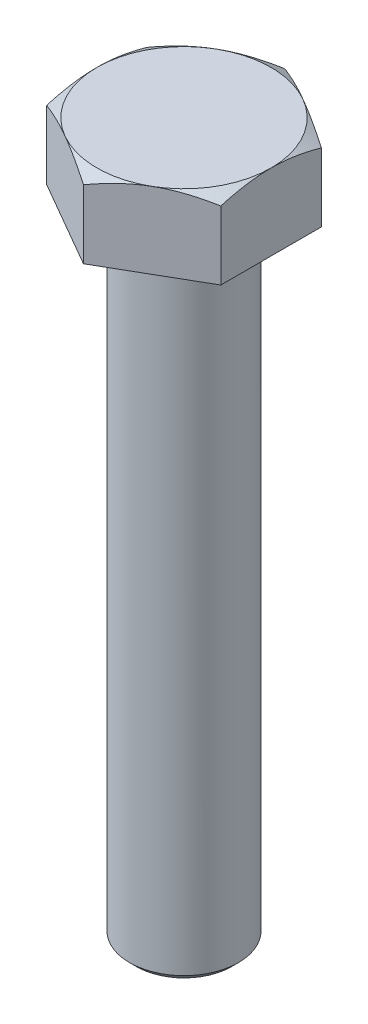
SolidWorks part; units mm, degrees
ref_plane "Front" through (0, 0, 0) normal (0, 0, 1) x (1, 0, 0)
ref_plane "Top" through (0, 0, 0) normal (0, 1, 0) x (1, 0, 0)
ref_plane "Right" through (0, 0, 0) normal (1, 0, 0) x (0, 0, -1)
sketch "Sketch1" plane through (0, 0, 0) normal (0, 1, 0) x (1, 0, 0)
  line L1 (0, 11.0851) -> (-9.6, 5.5426)
  line L2 (-9.6, 5.5426) -> (-9.6, -5.5426)
  line L3 (-9.6, -5.5426) -> (0, -11.0851)
  line L4 (0, -11.0851) -> (9.6, -5.5426)
  line L5 (9.6, -5.5426) -> (9.6, 5.5426)
  line L6 (9.6, 5.5426) -> (0, 11.0851)
  circle A0 centre (0, 0) radius 9.6 construction
  dimension "D1" = 19.2
extrude "Boss-Extrude1" add sketch "Sketch1" along normal blind 8.4
sketch "Sketch2" plane through (0, 0, 0) normal (0, -1, 0) x (-1, 0, 0)
  circle A0 centre (0, 0) radius 6
  dimension "D1" = 12
extrude "Boss-Extrude2" add sketch "Sketch2" along normal blind 70
sketch "Sketch3" plane through (0, 8.4, 0) normal (0, 1, 0) x (1, 0, 0)
  line L0 (9.6, 5.5426) -> (0, 11.0851) construction
  circle A0 centre (0, 0) radius 9.6
extrude "Cut-Extrude1" cut sketch "Sketch3" against normal blind 70 draft 60 flip side to cut
sketch "Sketch4" plane through (0, -70, 0) normal (0, -1, 0) x (-1, 0, 0)
  circle A0 centre (0, 0) radius 5.25
  dimension "D1" = 10.5
extrude "Cut-Extrude2" cut sketch "Sketch4" against normal blind 10 draft 45 flip side to cut contours A0
